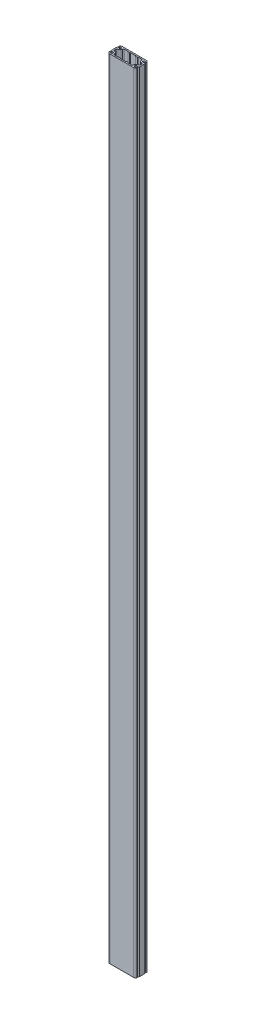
SolidWorks part; units mm, degrees
ref_plane "Alzado" through (0, 0, 0) normal (0, 0, 1) x (1, 0, 0)
ref_plane "Planta" through (0, 0, 0) normal (0, 1, 0) x (1, 0, 0)
ref_plane "Vista lateral" through (0, 0, 0) normal (1, 0, 0) x (0, 0, -1)
sketch "Croquis2" plane through (0, 0, 0) normal (0, 1, 0) x (1, 0, 0)
  line L0 (-183.2758, 0) -> (156.0252, 0) construction
  line L1 (0, 113.0945) -> (0, -113.0945) construction
  line L2 (90, -15.8204) -> (90, 15.8204)
  line L3 (75.5, 40) -> (-75.5, 40)
  line L4 (-17.4827, 32) -> (17.4827, 32)
  line L5 (20, 29) -> (30, 29)
  line L6 (123.5786, 25.5) -> (27.4214, 25.5) construction
  line L7 (75.5, 71.4027) -> (75.5, -20.4027) construction
  line L8 (82, 4.5) -> (82, -4.5)
  line L9 (20, 29) -> (17.4827, 32)
  line L10 (30, 29) -> (32.5173, 32)
  line L11 (32.5173, 32) -> (54.5, 32)
  line L12 (75.5, -71.4027) -> (75.5, 20.4027) construction
  line L13 (123.5786, -25.5) -> (27.4214, -25.5) construction
  line L14 (32.5173, -32) -> (54.5, -32)
  line L15 (30, -29) -> (32.5173, -32)
  line L16 (20, -29) -> (17.4827, -32)
  line L17 (20, -29) -> (30, -29)
  line L18 (-17.4827, -32) -> (17.4827, -32)
  line L19 (75.5, -40) -> (-75.5, -40)
  line L20 (-123.5786, -25.5) -> (-27.4214, -25.5) construction
  line L21 (-75.5, -71.4027) -> (-75.5, 20.4027) construction
  line L22 (-75.5, 71.4027) -> (-75.5, -20.4027) construction
  line L23 (-123.5786, 25.5) -> (-27.4214, 25.5) construction
  line L24 (-20, -29) -> (-30, -29)
  line L25 (-20, -29) -> (-17.4827, -32)
  line L26 (-30, -29) -> (-32.5173, -32)
  line L27 (-32.5173, -32) -> (-54.5, -32)
  line L28 (-32.5173, 32) -> (-54.5, 32)
  line L29 (-30, 29) -> (-32.5173, 32)
  line L30 (-20, 29) -> (-17.4827, 32)
  line L31 (-82, 4.5) -> (-82, -4.5)
  line L32 (-20, 29) -> (-30, 29)
  line L33 (-90, -15.8204) -> (-90, 15.8204)
  arc A0 (88.1963, 32.5039) -> (75.5, 40) centre (75.5, 25.5) ccw
  arc A1 (81.1914, 28.6397) -> (79.722, 20.5579) centre (75.5, 25.5) ccw
  arc A3 (61, 25.5) -> (54.5, 32) centre (54.5, 25.5) ccw
  arc A4 (81.1914, 28.6397) -> (88.1963, 32.5039) centre (84.6939, 30.5718) ccw
  arc A5 (90, 15.8204) -> (79.722, 20.5579) centre (83.7692, 15.8204) ccw
  arc A6 (82, 4.5) -> (75.5, 11) centre (75.5, 4.5) ccw
  arc A7 (61, 25.5) -> (75.5, 11) centre (75.5, 25.5) ccw
  arc A8 (61, -25.5) -> (75.5, -11) centre (75.5, -25.5) cw
  arc A9 (82, -4.5) -> (75.5, -11) centre (75.5, -4.5) cw
  arc A10 (90, -15.8204) -> (79.722, -20.5579) centre (83.7692, -15.8204) cw
  arc A11 (81.1914, -28.6397) -> (88.1963, -32.5039) centre (84.6939, -30.5718) cw
  arc A12 (61, -25.5) -> (54.5, -32) centre (54.5, -25.5) cw
  arc A13 (81.1914, -28.6397) -> (79.722, -20.5579) centre (75.5, -25.5) cw
  arc A14 (88.1963, -32.5039) -> (75.5, -40) centre (75.5, -25.5) cw
  arc A15 (-88.1963, -32.5039) -> (-75.5, -40) centre (-75.5, -25.5) ccw
  arc A16 (-81.1914, -28.6397) -> (-79.722, -20.5579) centre (-75.5, -25.5) ccw
  arc A17 (-61, -25.5) -> (-54.5, -32) centre (-54.5, -25.5) ccw
  arc A18 (-81.1914, -28.6397) -> (-88.1963, -32.5039) centre (-84.6939, -30.5718) ccw
  arc A19 (-90, -15.8204) -> (-79.722, -20.5579) centre (-83.7692, -15.8204) ccw
  arc A20 (-82, -4.5) -> (-75.5, -11) centre (-75.5, -4.5) ccw
  arc A21 (-61, -25.5) -> (-75.5, -11) centre (-75.5, -25.5) ccw
  arc A22 (-61, 25.5) -> (-75.5, 11) centre (-75.5, 25.5) cw
  arc A23 (-82, 4.5) -> (-75.5, 11) centre (-75.5, 4.5) cw
  arc A24 (-90, 15.8204) -> (-79.722, 20.5579) centre (-83.7692, 15.8204) cw
  arc A25 (-81.1914, 28.6397) -> (-88.1963, 32.5039) centre (-84.6939, 30.5718) cw
  arc A26 (-61, 25.5) -> (-54.5, 32) centre (-54.5, 25.5) cw
  arc A27 (-81.1914, 28.6397) -> (-79.722, 20.5579) centre (-75.5, 25.5) cw
  arc A28 (-88.1963, 32.5039) -> (-75.5, 40) centre (-75.5, 25.5) cw
  point P6 (0, 0)
  point P8 (-90, 0)
  point P9 (0, 40)
  point P17 (75.5, 25.5)
  point P20 (75.5, 25.5)
  point P56 (82, 0)
  point P58 (90, 0)
  point P94 (0, -40)
  point P95 (0, -32)
  point P102 (0, 32)
  point P103 (-82, 0)
  dimension "D5" = 14.5
  dimension "D6" = 6.5
  dimension "D7" = 6.2308
  dimension "D8" = 9.1939
  dimension "D1" = 90
  dimension "D2" = 40
  dimension "D3" = 8
  dimension "D4" = 8
  dimension "D9" = 21
  dimension "D10" = 10
  dimension "D11" = 20
  dimension "D12" = 3
  dimension "D13" = 50
  dimension "D14" = 50
extrude "Saliente-Extruir1" add sketch "Croquis2" along normal blind 5000
